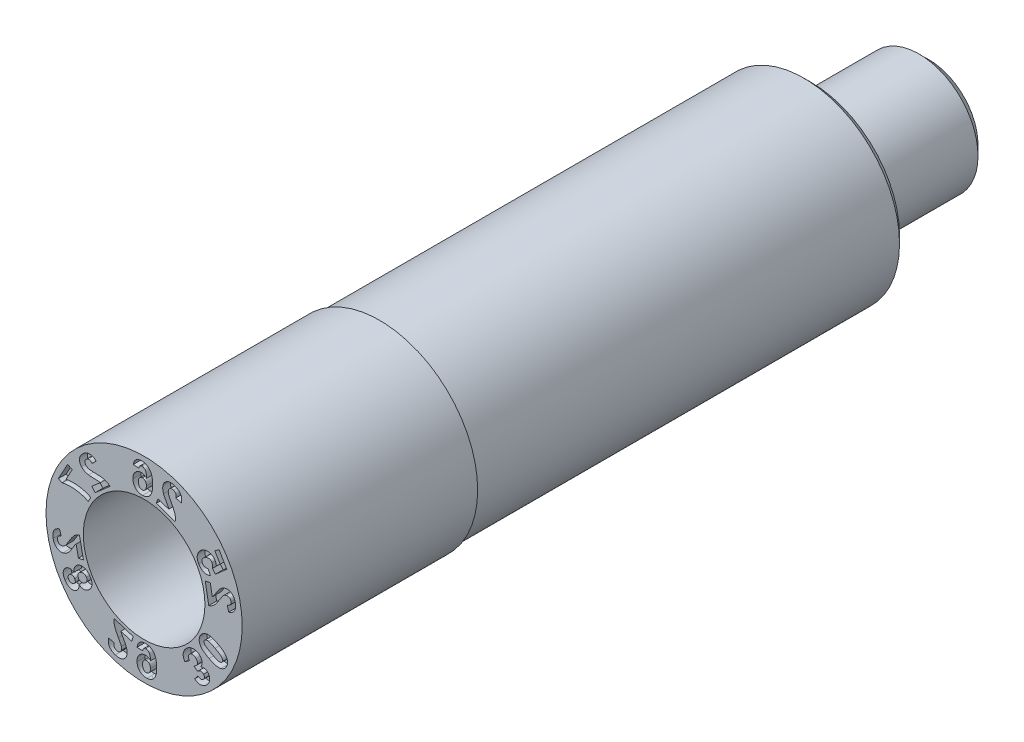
SolidWorks part; units mm, degrees
other "<M3 X .5 SHSS>-<Revolve1>"
ref_plane "Front Plane" through (0, 0, 0) normal (0, 0, 1) x (1, 0, 0)
ref_plane "Top Plane" through (0, 0, 0) normal (0, 1, 0) x (1, 0, 0)
ref_plane "Right Plane" through (0, 0, 0) normal (1, 0, 0) x (0, 0, -1)
sketch "Sketch1" plane through (0, 0, 0) normal (1, 0, 0) x (0, 0, -1)
  line L2 (0, 2.5) -> (0, 1.55)
  line L3 (16.75, 2.5) -> (0, 2.5)
  line L4 (-3.7979, 0) -> (49996.2021, 0) construction
  line L8 (14, 0.8) -> (2.8, 0.8)
  line L9 (2.8, 1.55) -> (2.8, 0.8)
  line L10 (2.8, 1.55) -> (0, 1.55)
  line L12 (17, 1.5) -> (17, 2.25)
  line L16 (17, 2.25) -> (16.75, 2.5)
  line L17 (17, 1.5) -> (14, 1.5)
  line L18 (14, 0.8) -> (14, 1.5)
  dimension "D1" = 17
  dimension "D2" = 45
  dimension "D3" = 0.25
  dimension "D4" = 5
  dimension "D5" = 3.1
  dimension "D6" = 2.8
  dimension "D7" = 1.6
  dimension "D8" = 3
  dimension "D9" = 3
revolve "Revolve1" add sketch "Sketch1" angle 360 about L4
sketch "Sketch4" plane through (0, 0, 0) normal (1, 0, 0) x (0, 0, -1)
  line L0 (0, 0) -> (50000, 0) construction
  line L1 (17, -2.25) -> (17, 2.25) construction
  line L2 (6, 3.435) -> (17, 3.435)
  line L3 (6, 3.435) -> (6, 2.435)
  line L4 (6, 2.435) -> (17, 2.435)
  line L5 (17, 3.435) -> (17, 2.435)
  line L6 (16.75, 2.5) -> (0, 2.5) construction
  line L7 (0, 2.5) -> (0, -2.5) construction
  dimension "D1" = 1
  dimension "D2" = 0.065
  dimension "D3" = 6
revolve "Cut-Revolve1" cut sketch "Sketch4" angle 360 about L0
sketch "Sketch2" plane through (0, 0, 0) normal (0, 0, 1) x (1, 0, 0)
  line L0 (0, 0) -> (0, 3.063) construction
  line L1 (0, 0) -> (2.6527, 1.5315) construction
  line L2 (0, 0) -> (2.6527, -1.5315) construction
  line L3 (0, 0) -> (0, -3.063) construction
  line L4 (0, 0) -> (-2.6527, -1.5315) construction
  line L5 (0, 0) -> (-2.6527, 1.5315) construction
  circle A0 centre (0, 0) radius 1.6531 construction
  text T0 "25  26  27  28  29  30" font "Arial" height 0.743
  point P10 (0, 0)
  point P405 (0, 0.0042)
  point P406 (0.0042, 0.0042)
  point P407 (0.0042, 0)
  dimension "D2" = 6
extrude "Cut-Extrude1" cut sketch "Sketch2" against normal blind 0.2
sketch "Sketch3" plane through (0, 0, -2.8) normal (0, 0, 1) x (1, 0, 0)
  line L0 (0, 0) -> (0, 50000) construction
  line L1 (0.4619, 0.8) -> (-0.4619, 0.8)
  line L2 (-0.4619, 0.8) -> (-0.9238, 0)
  line L3 (-0.9238, 0) -> (-0.4619, -0.8)
  line L4 (-0.4619, -0.8) -> (0.4619, -0.8)
  line L5 (0.4619, -0.8) -> (0.9238, 0)
  line L6 (0.9238, 0) -> (0.4619, 0.8)
  line L7 (0, 0) -> (50000, 0) construction
  circle A0 centre (0, 0) radius 0.8 construction
  circle A1 centre (0, 0) radius 0.8 construction
extrude "Cut-Extrude2" cut sketch "Sketch3" against normal blind 1.4
inserted part "M3 X .5 SHSS"
move or copy body "Body-Move/Copy2" placed by mates yes
